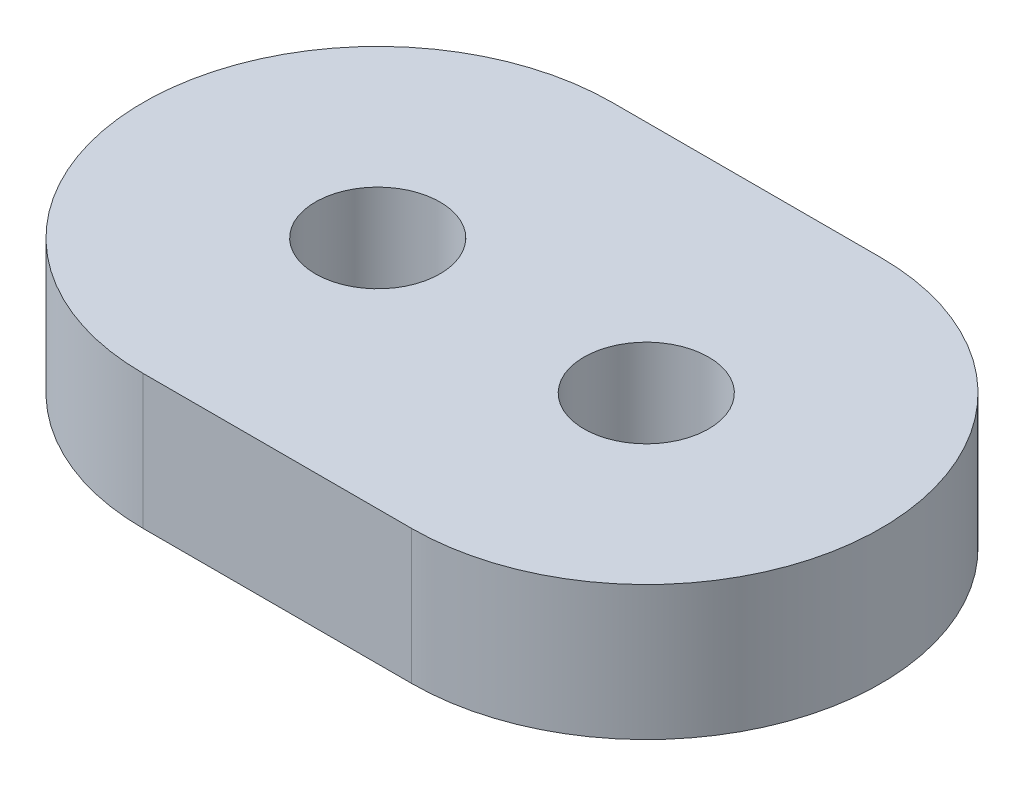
SolidWorks part; units mm, degrees
ref_plane "Front Plane" through (0, 0, 0) normal (0, 0, 1) x (1, 0, 0)
ref_plane "Top Plane" through (0, 0, 0) normal (0, 1, 0) x (1, 0, 0)
ref_plane "Right Plane" through (0, 0, 0) normal (1, 0, 0) x (0, 0, -1)
sketch "Sketch1" plane through (0, 0, 0) normal (0, 1, 0) x (1, 0, 0)
  line L0 (-17.2093, 34.996) -> (-17.2093, 35.0421)
  line L5 (17.2093, 34.996) -> (17.2093, 35.0421)
  line L6 (3.175, 24.5204) -> (-3.175, 24.5204) construction
  line L7 (3.175, 18.9735) -> (-3.175, 18.9735)
  line L8 (3.175, 30.0673) -> (-3.175, 30.0673)
  circle A1 centre (-3.175, 24.5204) radius 1.4732
  circle A2 centre (3.175, 24.5204) radius 1.4732
  arc A8 (3.175, 18.9735) -> (3.175, 30.0673) centre (3.175, 24.5204) ccw
  arc A9 (-3.175, 30.0673) -> (-3.175, 18.9735) centre (-3.175, 24.5204) ccw
  point P11 (0, 24.5204)
  dimension "D1" = 6.35
extrude "Extrude1" add sketch "Sketch1" along normal blind 3.175 contours L8 A9 L7 A8 | A1 | A2
